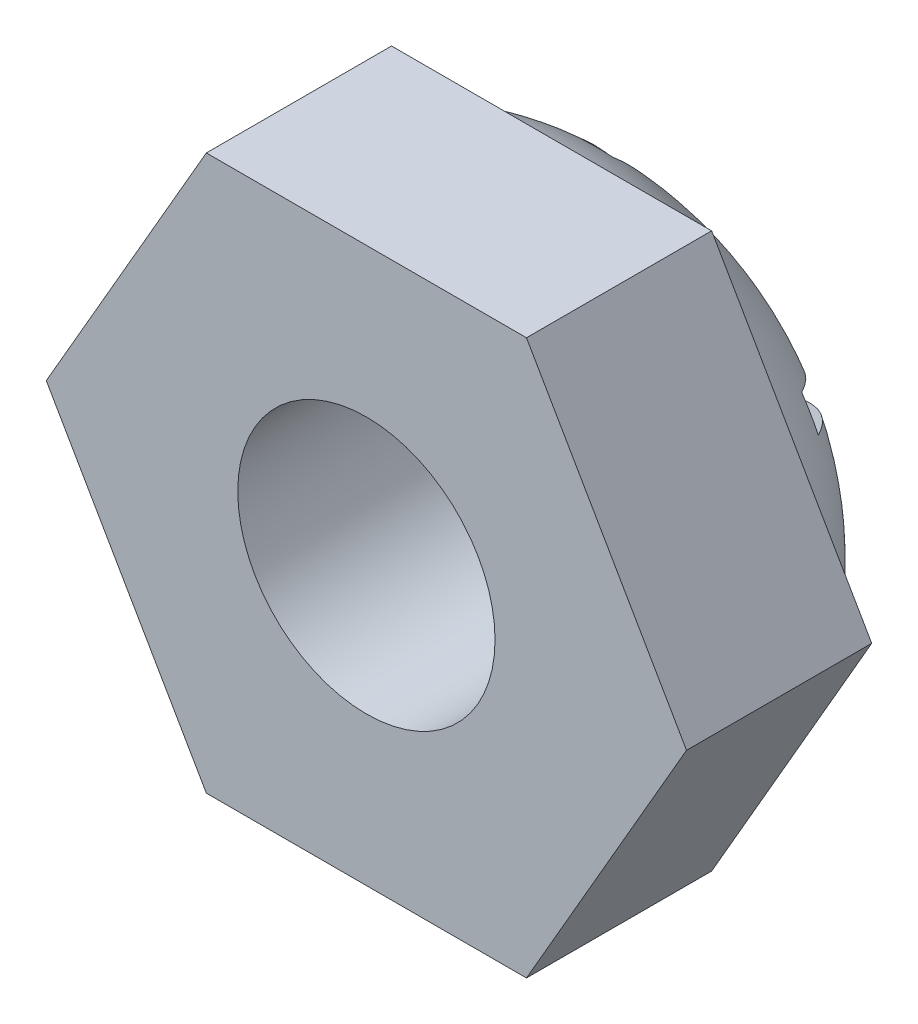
SolidWorks part; units mm, degrees
ref_plane "Front" through (0, 0, 0) normal (0, 0, 1) x (1, 0, 0)
ref_plane "Top" through (0, 0, 0) normal (0, 1, 0) x (1, 0, 0)
ref_plane "Right" through (0, 0, 0) normal (1, 0, 0) x (0, 0, -1)
sketch "Sketch1" plane through (0, 0, 0) normal (0, 0, 1) x (1, 0, 0)
  line L1 (1.8331, 3.175) -> (-1.8331, 3.175)
  line L2 (-1.8331, 3.175) -> (-3.6662, 0)
  line L3 (-3.6662, 0) -> (-1.8331, -3.175)
  line L4 (-1.8331, -3.175) -> (1.8331, -3.175)
  line L5 (1.8331, -3.175) -> (3.6662, 0)
  line L6 (3.6662, 0) -> (1.8331, 3.175)
  circle A0 centre (0, 0) radius 3.175 construction
  dimension "D1" = 6.35
extrude "Boss-Extrude1" add sketch "Sketch1" along normal blind 2.1209
sketch "Sketch2" plane through (0, 0, 0) normal (0, 1, 0) x (1, 0, 0)
  line L0 (0, 0) -> (-3.175, 0)
  line L1 (0, 1.778) -> (0, 0)
  spline S0 degree 2 poles (-3.175, 0) (-2.3945, 1.5102) (0, 1.778) knots 0 0 0 1 1 1
  dimension "D1" = 3.175
  dimension "D2" = 1.778
revolve "Revolve1" add sketch "Sketch2" angle 360 about L1
hole_wizard "#4 Clearance Hole1" positions "Sketch4" profile "Sketch3" hole size "#4" standard "ANSI Inch"
sketch "Sketch4" plane through (0, 0, 2.1209) normal (0, 0, 1) x (1, 0, 0)
  point P0 (0, 0)
sketch "Sketch3" plane through (0, 0, 2.1209) normal (1, 0, 0) x (0, -1, 0)
  line L0 (0, 0) -> (0, 3.8989)
  line L1 (0, 3.8989) -> (1.4732, 3.8989)
  line L2 (1.4732, 3.8989) -> (1.4732, 0)
  line L5 (1.4732, 0) -> (0, 0)
  line L11 (0, -6.35) -> (0, 107.95) construction
  dimension "Thru Hole Dia." = 2.9464
  dimension "Thru Hole Depth" = 3.8989
ref_plane "Plane1" through (0, 0, -0.508) normal (0, 0, -1) x (-1, 0, 0)
sketch "Sketch5" plane through (0, 0, -0.508) normal (0, 0, -1) x (-1, 0, 0)
  line L0 (50, 0) -> (-50, 0) construction
  line L1 (-0.1905, 0) -> (0.1905, 0)
  line L2 (-0.1905, 0) -> (-0.1905, 3.7649)
  line L3 (-0.1905, 3.7649) -> (0.1905, 3.7649)
  line L4 (0.1905, 0) -> (0.1905, 3.7649)
  point P6 (0, 0)
  dimension "D1" = 0.381
extrude "Cut-Extrude1" cut sketch "Sketch5" along normal through all
pattern_circular "CirPattern1" count 6 over 360 about axis through (0, 0, 0) along (0, 0, 1) of "Cut-Extrude1"
